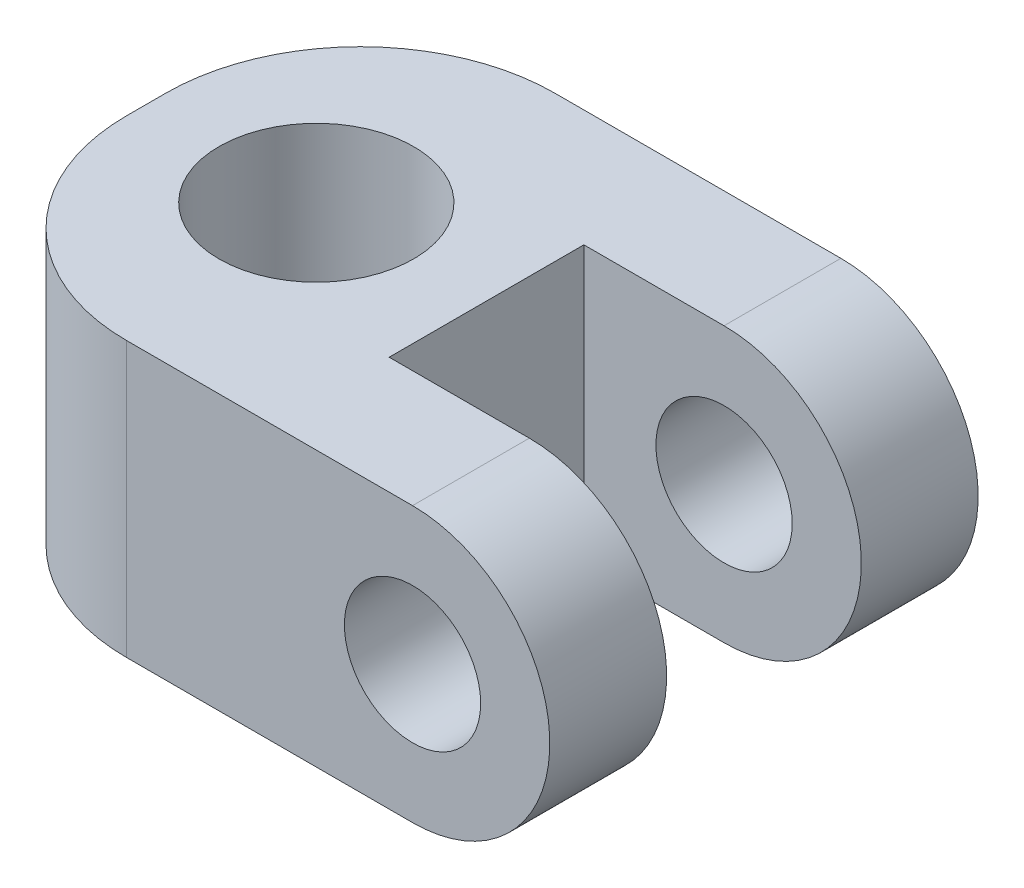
SolidWorks part; units mm, degrees
ref_plane "Front Plane" through (0, 0, 0) normal (0, 0, 1) x (1, 0, 0)
ref_plane "Top Plane" through (0, 0, 0) normal (0, 1, 0) x (1, 0, 0)
ref_plane "Right Plane" through (0, 0, 0) normal (1, 0, 0) x (0, 0, -1)
sketch "Sketch1" plane through (0, 0, 0) normal (0, 0, 1) x (1, 0, 0)
  line L0 (-22.6, 16.75) -> (-14.55, 16.75) construction
  line L1 (-19.075, 25.775) -> (-31.4162, 25.775)
  line L3 (-31.4162, 25.775) -> (-31.4162, 18.725)
  line L4 (-2.55, 16.75) -> (5.5, 16.75) construction
  line L5 (-31.4162, 18.725) -> (-19.075, 18.725)
  line L6 (-22.6, 25.775) -> (-22.6, 18.725) construction
  line L8 (-22.6, 5.5) -> (-22.6, 28) construction
  line L9 (-22.6, 28) -> (5.5, 28) construction
  line L11 (5.5, 28) -> (5.5, 5.5) construction
  line L14 (-19.85, 28) -> (2.75, 28) construction
  line L17 (2.75, 28) -> (-8.55, 16.75) construction
  line L32 (-19.85, 28) -> (2.75, 28) construction
  line L34 (-19.85, 28) -> (-22.6, 28) construction
  line L35 (-22.6, 28) -> (-22.6, 16.75) construction
  line L36 (1.975, 16.75) -> (1.975, 22.25) construction
  line L37 (2.75, 28) -> (5.5, 28) construction
  line L38 (5.5, 28) -> (5.5, 16.75) construction
  line L39 (-19.075, 16.75) -> (-19.075, 22.25) construction
  line L41 (-8.55, 16.75) -> (-19.85, 28) construction
  circle A2 centre (1.975, 22.25) radius 1.75 construction
  circle A3 centre (-19.075, 22.25) radius 1.75 construction
  arc A5 (-2.55, 16.75) -> (-14.55, 16.75) centre (-8.55, 16.75) ccw construction
  circle A6 centre (-19.075, 22.25) radius 1.75
  arc A7 (-19.075, 18.725) -> (-19.075, 25.775) centre (-19.075, 22.25) ccw
  dimension "D1" = 3.525
  dimension "D2" = 22.5
  dimension "D4" = 12
  dimension "D5" = 3.5
  dimension "D3" = 28.1
extrude "Boss-Extrude1" add sketch "Sketch1" along normal blind 3
sketch "Sketch2" plane through (0, 0, 3) normal (0, 0, 1) x (1, 0, 0)
  line L0 (-19.075, 22.25) -> (-22.675, 22.25) construction
  line L1 (-22.675, 25.775) -> (-22.675, 18.725)
  line L2 (-31.4162, 18.725) -> (-19.075, 18.725) construction
  line L3 (-22.675, 18.725) -> (-31.4162, 18.725)
  line L4 (-31.4162, 18.725) -> (-31.4162, 25.775)
  line L5 (-31.4162, 25.775) -> (-22.675, 25.775)
  point P8 (-22.675, 22.25)
  dimension "D1" = 3.6
extrude "Boss-Extrude2" add sketch "Sketch2" along normal blind 5
sketch "Sketch3" plane through (0, 0, 8) normal (0, 0, 1) x (1, 0, 0)
  line L0 (-19.075, 25.775) -> (-31.4162, 25.775)
  line L1 (-31.4162, 25.775) -> (-31.4162, 18.725)
  line L2 (-31.4162, 18.725) -> (-19.075, 18.725)
  circle A0 centre (-19.075, 22.25) radius 1.75
  arc A1 (-19.075, 18.725) -> (-19.075, 25.775) centre (-19.075, 22.25) ccw
extrude "Boss-Extrude3" add sketch "Sketch3" along normal blind 3
sketch "Sketch4" plane through (0, 25.775, 0) normal (0, 1, 0) x (1, 0, 0)
  line L0 (-22.675, -8) -> (-22.675, -11) construction
  line L1 (-19.075, -11) -> (-31.4162, -11) construction
  line L2 (-22.675, -11) -> (-31.4162, 0) construction
  circle A0 centre (-27.0456, -5.5) radius 2.5
  dimension "D1" = 5
extrude "Cut-Extrude1" cut sketch "Sketch4" against normal through all
fillet "Fillet1" radius 5 2 edges at (-31.4162, 22.25, 11) (-31.4162, 22.25, 0)
